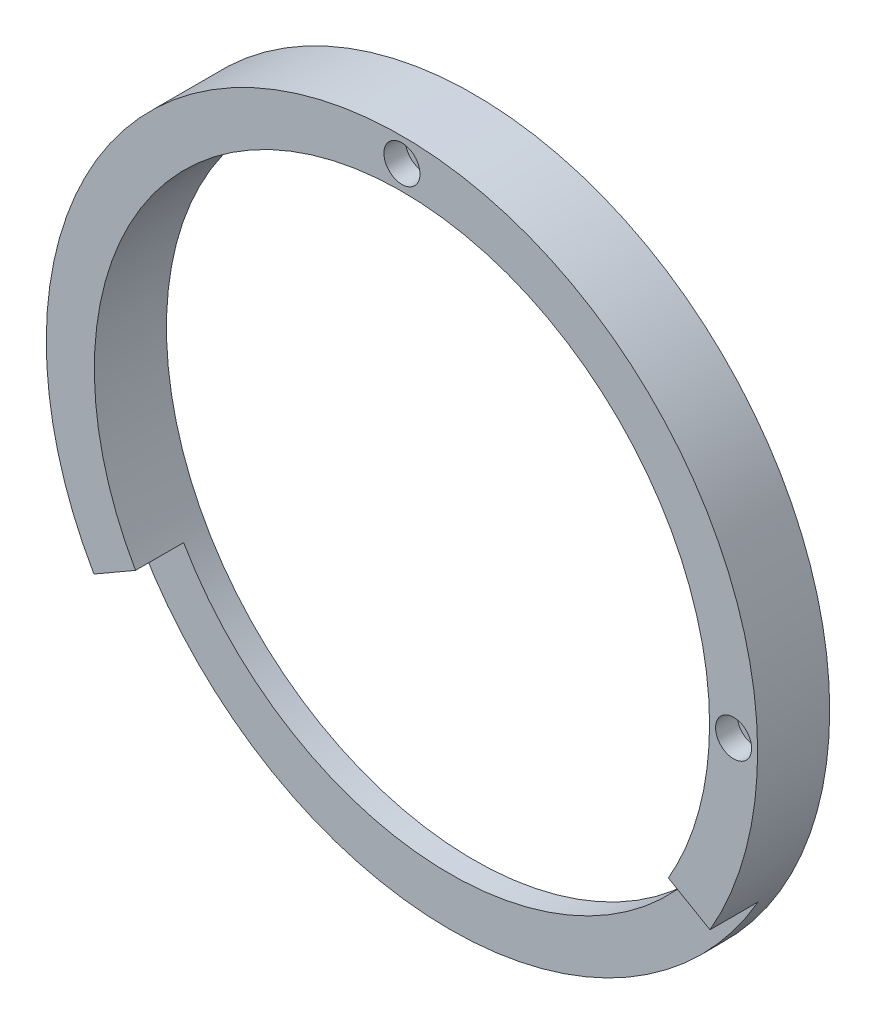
SolidWorks part; units mm, degrees
ref_plane "Plan1" through (0, 0, 0) normal (0, 0, 1) x (1, 0, 0)
ref_plane "Plan2" through (0, 0, 0) normal (0, 1, 0) x (1, 0, 0)
ref_plane "Plan3" through (0, 0, 0) normal (1, 0, 0) x (0, 0, -1)
sketch "Esquisse1" plane through (0, 0, 0) normal (0, 0, 1) x (1, 0, 0)
  circle A0 centre (0, 0) radius 74
  dimension "D1" = 148
extrude "Base-Extrusion" add sketch "Esquisse1" along normal blind 15
sketch "Esquisse2" plane through (0, 0, 15) normal (0, 0, 1) x (1, 0, 0)
  circle A0 centre (0, 0) radius 64
  dimension "D1" = 128
extrude "Enlèv. mat.-Extru.1" cut sketch "Esquisse2" against normal through all
sketch "Esquisse3" plane through (0, 0, 15) normal (0, 0, 1) x (1, 0, 0)
  line L0 (-84.2, 0) -> (85.8005, 0) construction
  line L1 (55.4256, -32) -> (64.0859, -37)
  line L6 (-55.4256, -32) -> (-64.0859, -37)
  circle A0 centre (0, 0) radius 74 construction
  arc A1 (-64.0859, -37) -> (64.0859, -37) centre (0, 0) ccw
  circle A2 centre (0, 0) radius 64 construction
  arc A3 (-55.4256, -32) -> (55.4256, -32) centre (0, 0) ccw
  dimension "D1" = 30
  dimension "D2" = 30
extrude "Enlèv. mat.-Extru.2" cut sketch "Esquisse3" against normal blind 10
other "Perçage1"
sketch "Esquisse4" plane through (0, 0, 15) normal (0, 0, 1) x (1, 0, 0)
  circle A0 centre (69, 0) radius 2.25
  dimension "D1" = 4.5
  dimension "D2" = 69
pattern_circular "Répétition circulaire1" count 2 every 90
other "Perçage2" parameters "D1"=4.5
sketch "Esquisse5" plane through (0, 0, 15) normal (0, 0, 1) x (1, 0, 0)
  circle A0 centre (69, 0) radius 3.75
  dimension "D1" = 7.5
pattern_circular "Répétition circulaire2" count 2 every 90
